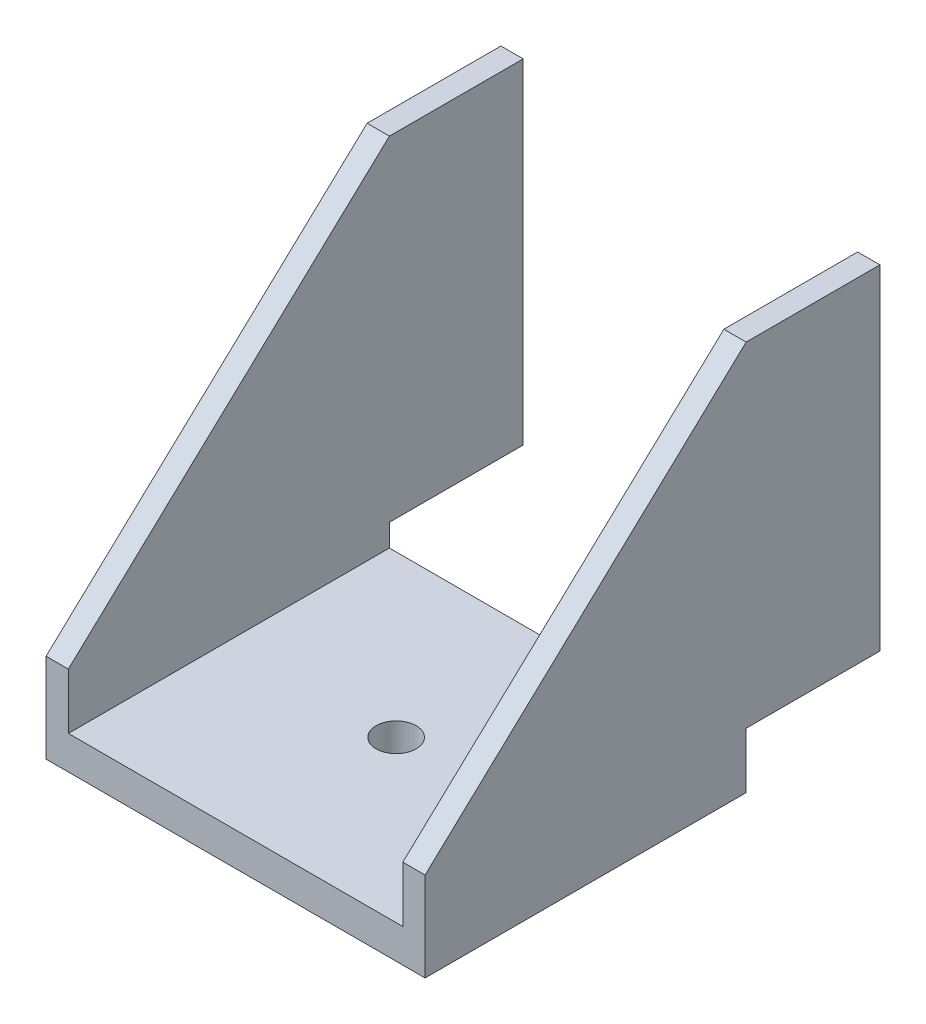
SolidWorks part; units mm, degrees
ref_plane "Front Plane" through (0, 0, 0) normal (0, 0, 1) x (1, 0, 0)
ref_plane "Top Plane" through (0, 0, 0) normal (0, 1, 0) x (1, 0, 0)
ref_plane "Right Plane" through (0, 0, 0) normal (1, 0, 0) x (0, 0, -1)
sketch "Sketch1" plane through (0, 0, 0) normal (1, 0, 0) x (0, 0, -1)
  line L0 (60, 150) -> (60, 0)
  line L1 (60, 0) -> (0, 0)
  line L2 (0, 0) -> (0, -25)
  line L3 (0, -25) -> (-144, -25)
  line L4 (-144, -25) -> (-144, 15)
  line L5 (0, 150) -> (60, 150)
  line L7 (-144, 15) -> (0, 150)
  dimension "D1" = 150
  dimension "D2" = 60
  dimension "D3" = 175
  dimension "D4" = 144
  dimension "D5" = 40
extrude "Boss-Extrude1" add sketch "Sketch1" along normal blind 10
pattern_linear "LPattern1" count 2 spacing 160 along (-1, 0, 0) of "Boss-Extrude1"
sketch "Sketch2" plane through (0, -25, 0) normal (0, -1, 0) x (1, 0, 0)
  line L0 (-75, 144) -> (-75, 0) construction
  line L1 (10, 144) -> (-160, 144)
  line L2 (10, 144) -> (10, 0)
  line L3 (10, 0) -> (-160, 0)
  line L4 (-160, 144) -> (-160, 0)
  circle A0 centre (-75, 72) radius 9
  dimension "D1" = 18
extrude "Boss-Extrude2" add sketch "Sketch2" against normal blind 15
